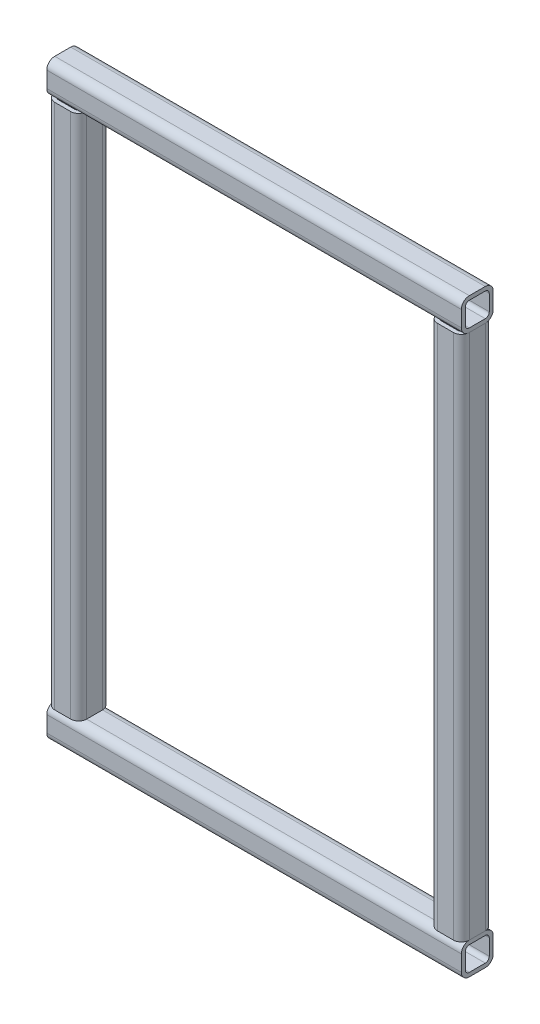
SolidWorks part; units mm, degrees
ref_plane "Front Plane" through (0, 0, 0) normal (0, 0, 1) x (1, 0, 0)
ref_plane "Top Plane" through (0, 0, 0) normal (0, 1, 0) x (1, 0, 0)
ref_plane "Right Plane" through (0, 0, 0) normal (1, 0, 0) x (0, 0, -1)
sketch "Sketch1" plane through (0, 0, 0) normal (0, 0, 1) x (1, 0, 0)
  line L1 (0, 0) -> (609.6, 0)
  line L2 (0, 0) -> (0, 889)
  line L3 (0, 889) -> (609.6, 889)
  line L4 (609.6, 0) -> (609.6, 889)
  dimension "D1" = 609.6
  dimension "D2" = 889
other "Structural Member1"
ref_plane "Plane1" through (0, 0, 0) normal (0, 1, 0) x (-1, 0, 0)
sketch "Sketch11" plane through (0, 0, 0) normal (0, 1, 0) x (-1, 0, 0)
  line L0 (-12.7, -19.05) -> (12.7, -19.05)
  line L1 (-19.05, -12.7) -> (-19.05, 12.7)
  line L2 (12.7, 19.05) -> (-12.7, 19.05)
  line L3 (19.05, 12.7) -> (19.05, -12.7)
  line L4 (-12.7, -25.4) -> (12.7, -25.4)
  line L5 (-25.4, -12.7) -> (-25.4, 12.7)
  line L6 (12.7, 25.4) -> (-12.7, 25.4)
  line L7 (25.4, 12.7) -> (25.4, -12.7)
  line L8 (0, 0) -> (19.05, 0) construction
  line L9 (0, 0) -> (0, 19.05) construction
  arc A0 (25.4, 12.7) -> (12.7, 25.4) centre (12.7, 12.7) ccw
  arc A1 (12.7, -25.4) -> (25.4, -12.7) centre (12.7, -12.7) ccw
  arc A2 (-25.4, -12.7) -> (-12.7, -25.4) centre (-12.7, -12.7) ccw
  arc A3 (-12.7, 25.4) -> (-25.4, 12.7) centre (-12.7, 12.7) ccw
  arc A4 (-12.7, 19.05) -> (-19.05, 12.7) centre (-12.7, 12.7) ccw
  arc A5 (19.05, 12.7) -> (12.7, 19.05) centre (12.7, 12.7) ccw
  arc A6 (12.7, -19.05) -> (19.05, -12.7) centre (12.7, -12.7) ccw
  arc A7 (-19.05, -12.7) -> (-12.7, -19.05) centre (-12.7, -12.7) ccw
  point P3 (0, 25.4)
  point P4 (25.4, 0)
  point P5 (0, -25.4)
  point P6 (-25.4, 0)
  point P7 (-25.4, 25.4)
  point P8 (-25.4, -25.4)
  point P33 (0, 0)
  point P35 (25.4, -25.4)
  point P36 (25.4, 25.4)
  point P37 (0, 0)
  dimension "D1" = 12.7
  dimension "Thickness" = 6.35
  dimension "V_leg" = 50.8
